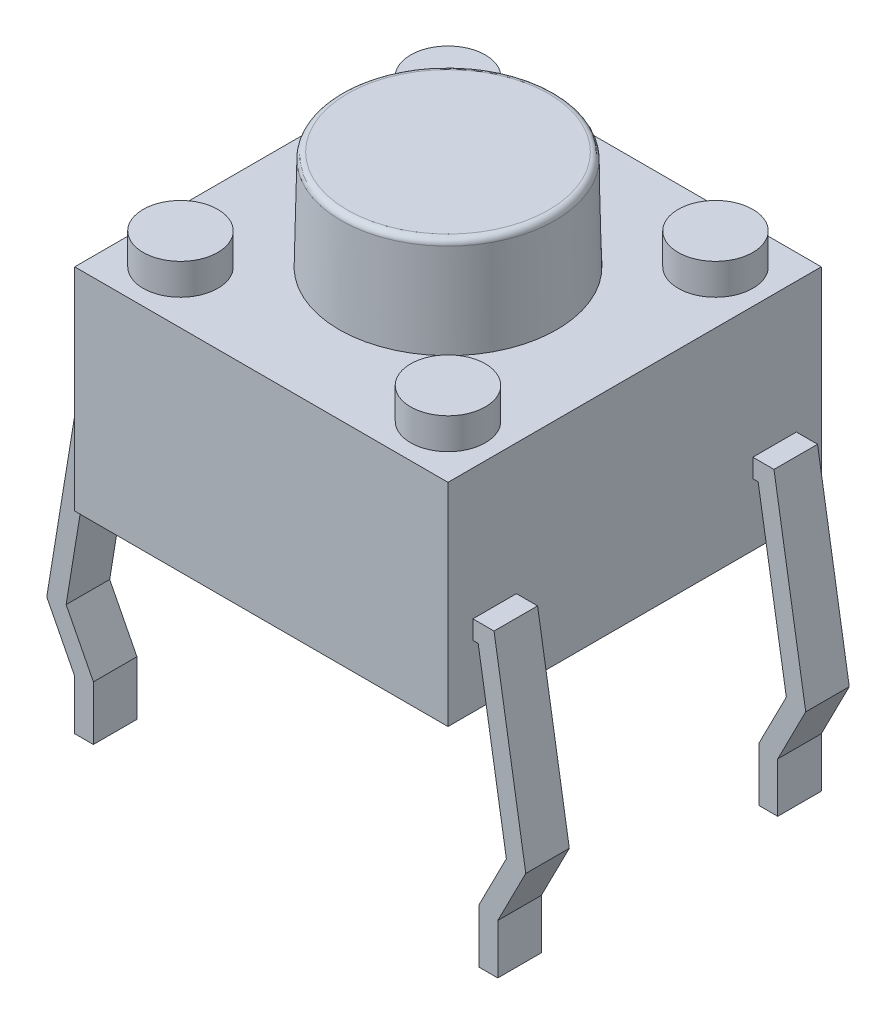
SolidWorks part; units mm, degrees
ref_plane "Piano frontale" through (0, 0, 0) normal (0, 0, 1) x (1, 0, 0)
ref_plane "Piano superiore" through (0, 0, 0) normal (0, 1, 0) x (1, 0, 0)
ref_plane "Piano destro" through (0, 0, 0) normal (1, 0, 0) x (0, 0, -1)
ref_plane "Piano1" through (0, 2, 0) normal (0, -1, 0) x (1, 0, 0)
sketch "Schizzo1" plane through (0, 2, 0) normal (0, -1, 0) x (1, 0, 0)
  line L0 (-7.16, -14) -> (-13.84, -14)
  line L1 (-13.84, -14) -> (-13.84, -17.8)
  line L2 (-13.84, -17.8) -> (-7.16, -17.8)
  line L3 (-7.16, -17.8) -> (-7.16, -14)
extrude "Estrusione-Estrusione1" add sketch "Schizzo1" against normal blind 2.4
sketch "Schizzo2" plane through (0, 0, -14) normal (0, 0, 1) x (1, 0, 0)
  line L0 (-7.4149, 2) -> (-13.5851, 2)
  line L1 (-13.5851, 2) -> (-14.038, -0.7711)
  line L2 (-14.038, -0.7711) -> (-13.6, -1.6277)
  line L3 (-13.6, -1.6277) -> (-13.6, -2.5)
  line L4 (-13.6, -2.5) -> (-14.6246, -2.5)
  line L5 (-14.6246, -2.5) -> (-13.84, 2.3)
  line L6 (-13.84, 2.3) -> (-13.84, 4.4)
  line L7 (-13.84, 4.4) -> (-7.16, 4.4)
  line L8 (-7.16, 4.4) -> (-7.16, 2.3)
  line L9 (-7.16, 2.3) -> (-6.3754, -2.5)
  line L10 (-6.3754, -2.5) -> (-7.4, -2.5)
  line L11 (-7.4, -2.5) -> (-7.4, -1.6277)
  line L12 (-7.4, -1.6277) -> (-6.962, -0.7711)
  line L13 (-6.962, -0.7711) -> (-7.4149, 2)
extrude "Estrusione-Estrusione2" add sketch "Schizzo2" along normal blind 0.7
sketch "Schizzo3" plane through (0, 0, -17.8) normal (0, 0, -1) x (-1, 0, 0)
  line L0 (13.84, 2.3) -> (14.6246, -2.5)
  line L1 (14.6246, -2.5) -> (13.6, -2.5)
  line L2 (13.6, -2.5) -> (13.6, -1.6277)
  line L3 (13.6, -1.6277) -> (14.038, -0.7711)
  line L4 (14.038, -0.7711) -> (13.5851, 2)
  line L5 (13.5851, 2) -> (7.4149, 2)
  line L6 (7.4149, 2) -> (6.962, -0.7711)
  line L7 (6.962, -0.7711) -> (7.4, -1.6277)
  line L8 (7.4, -1.6277) -> (7.4, -2.5)
  line L9 (7.4, -2.5) -> (6.3754, -2.5)
  line L10 (6.3754, -2.5) -> (7.16, 2.3)
  line L11 (7.16, 2.3) -> (7.16, 4.4)
  line L12 (7.16, 4.4) -> (13.84, 4.4)
  line L13 (13.84, 4.4) -> (13.84, 2.3)
extrude "Estrusione-Estrusione3" add sketch "Schizzo3" along normal blind 0.7
sketch "Schizzo4" plane through (0, 0, -13.3) normal (0, 0, 1) x (1, 0, 0)
  line L0 (-7.16, 2) -> (-13.84, 2)
  line L1 (-13.84, 2) -> (-13.84, 4.4)
  line L2 (-13.84, 4.4) -> (-7.16, 4.4)
  line L3 (-7.16, 4.4) -> (-7.16, 2)
extrude "Estrusione-Estrusione4" add sketch "Schizzo4" along normal blind 0.4
sketch "Schizzo5" plane through (-13.84, 0, 0) normal (-1, 0, 0) x (0, 0, 1)
  line L0 (-12.9, 4.4) -> (-18.5, 4.4)
  line L1 (-18.5, 4.4) -> (-18.5, 2.3)
  line L2 (-18.5, 2.3) -> (-17.8, 2.3)
  line L3 (-17.8, 2.3) -> (-17.8, 2)
  line L4 (-17.8, 2) -> (-14, 2)
  line L5 (-14, 2) -> (-14, 2.3)
  line L6 (-14, 2.3) -> (-13.3, 2.3)
  line L7 (-13.3, 2.3) -> (-13.3, 2)
  line L8 (-13.3, 2) -> (-12.9, 2)
  line L9 (-12.9, 2) -> (-12.9, 4.4)
extrude "Taglio-Estrusione1" cut sketch "Schizzo5" against normal blind 0.34
sketch "Schizzo6" plane through (-7.16, 0, 0) normal (1, 0, 0) x (0, 0, -1)
  line L0 (17.8, 2.3) -> (18.5, 2.3)
  line L1 (18.5, 2.3) -> (18.5, 4.4)
  line L2 (18.5, 4.4) -> (12.9, 4.4)
  line L3 (12.9, 4.4) -> (12.9, 2)
  line L4 (12.9, 2) -> (13.3, 2)
  line L5 (13.3, 2) -> (13.3, 2.3)
  line L6 (13.3, 2.3) -> (14, 2.3)
  line L7 (14, 2.3) -> (14, 2)
  line L8 (14, 2) -> (17.8, 2)
  line L9 (17.8, 2) -> (17.8, 2.3)
extrude "Taglio-Estrusione2" cut sketch "Schizzo6" against normal blind 0.34
sketch "Schizzo7" plane through (0, 0, -18.5) normal (0, 0, -1) x (-1, 0, 0)
  line L0 (7.5, 2) -> (7.5, 4.4)
  line L1 (7.5, 4.4) -> (13.5, 4.4)
  line L2 (13.5, 4.4) -> (13.5, 2)
  line L3 (13.5, 2) -> (7.5, 2)
extrude "Estrusione-Estrusione5" add sketch "Schizzo7" along normal blind 0.4
sketch "Schizzo8" plane through (0, 2, 0) normal (0, -1, 0) x (1, 0, 0)
  line L0 (-7.5, -12.9) -> (-7.5, -18.9)
  line L1 (-7.5, -18.9) -> (-13.5, -18.9)
  line L2 (-13.5, -18.9) -> (-13.5, -12.9)
  line L3 (-13.5, -12.9) -> (-7.5, -12.9)
extrude "Estrusione-Estrusione6" add sketch "Schizzo8" along normal blind 1
sketch "Schizzo9" plane through (0, 0, -13.3) normal (0, 0, 1) x (1, 0, 0)
  line L0 (-13.9, -2.5) -> (-13.9, -1.7)
  line L1 (-13.9, -1.7) -> (-14.35, -0.82)
  line L2 (-14.35, -0.82) -> (-14.6246, -2.5)
  line L3 (-14.6246, -2.5) -> (-13.9, -2.5)
extrude "Taglio-Estrusione3" cut sketch "Schizzo9" against normal up to next
sketch "Schizzo10" plane through (0, 0, -18.5) normal (0, 0, -1) x (-1, 0, 0)
  line L0 (14.6246, -2.5) -> (14.35, -0.82)
  line L1 (14.35, -0.82) -> (13.9, -1.7)
  line L2 (13.9, -1.7) -> (13.9, -2.5)
  line L3 (13.9, -2.5) -> (14.6246, -2.5)
extrude "Taglio-Estrusione4" cut sketch "Schizzo10" against normal up to next
sketch "Schizzo11" plane through (0, 0, -13.3) normal (0, 0, 1) x (1, 0, 0)
  line L0 (-6.65, -0.82) -> (-7.1, -1.7)
  line L1 (-7.1, -1.7) -> (-7.1, -2.5)
  line L2 (-7.1, -2.5) -> (-6.3754, -2.5)
  line L3 (-6.3754, -2.5) -> (-6.65, -0.82)
extrude "Taglio-Estrusione5" cut sketch "Schizzo11" against normal up to next
sketch "Schizzo12" plane through (0, 0, -18.5) normal (0, 0, -1) x (-1, 0, 0)
  line L0 (6.3754, -2.5) -> (7.1, -2.5)
  line L1 (7.1, -2.5) -> (7.1, -1.7)
  line L2 (7.1, -1.7) -> (6.65, -0.82)
  line L3 (6.65, -0.82) -> (6.3754, -2.5)
extrude "Taglio-Estrusione6" cut sketch "Schizzo12" against normal through all
ref_plane "Piano2" through (0, 0, -18.05) normal (0, 0, 1) x (1, 0, 0)
sketch "Schizzo13" plane through (0, 0, -18.05) normal (0, 0, 1) x (1, 0, 0)
  line L0 (-7.75, 4.9) -> (-8.35, 4.9)
  line L1 (-8.35, 4.9) -> (-8.35, 4.4)
  line L2 (-8.35, 4.4) -> (-7.75, 4.4)
  line L3 (-7.75, 4.4) -> (-7.75, 4.9)
  line L4 (-8.35, 4.9) -> (-8.35, 4.4) construction
revolve "Rivoluzione1" add sketch "Schizzo13" angle 360 about L4
ref_plane "Piano3" through (0, 0, -13.75) normal (0, 0, 1) x (1, 0, 0)
sketch "Schizzo14" plane through (0, 0, -13.75) normal (0, 0, 1) x (1, 0, 0)
  line L0 (-12.05, 4.9) -> (-12.65, 4.9)
  line L1 (-12.65, 4.9) -> (-12.65, 4.4)
  line L2 (-12.65, 4.4) -> (-12.05, 4.4)
  line L3 (-12.05, 4.4) -> (-12.05, 4.9)
  line L4 (-12.65, 4.9) -> (-12.65, 4.4) construction
revolve "Rivoluzione2" add sketch "Schizzo14" angle 360 about L4
sketch "Schizzo15" plane through (0, 0, -18.05) normal (0, 0, 1) x (1, 0, 0)
  line L0 (-12.05, 4.9) -> (-12.65, 4.9)
  line L1 (-12.65, 4.9) -> (-12.65, 4.4)
  line L2 (-12.65, 4.4) -> (-12.05, 4.4)
  line L3 (-12.05, 4.4) -> (-12.05, 4.9)
  line L4 (-12.65, 4.9) -> (-12.65, 4.4) construction
revolve "Rivoluzione3" add sketch "Schizzo15" angle 360 about L4
sketch "Schizzo16" plane through (0, 0, -13.75) normal (0, 0, 1) x (1, 0, 0)
  line L0 (-7.75, 4.9) -> (-8.35, 4.9)
  line L1 (-8.35, 4.9) -> (-8.35, 4.4)
  line L2 (-8.35, 4.4) -> (-7.75, 4.4)
  line L3 (-7.75, 4.4) -> (-7.75, 4.9)
  line L4 (-8.35, 4.9) -> (-8.35, 4.4) construction
revolve "Rivoluzione4" add sketch "Schizzo16" angle 360 about L4
hole_wizard "Foro Ø3.5 (3.5)-1" positions "Schizzo18" profile "Schizzo17" hole size "Ø3.5" standard "Ansi Metric"
sketch "Schizzo18" plane through (0, 4.4, 0) normal (0, 1, 0) x (1, 0, 0)
  point P0 (-10.5, 15.9)
sketch "Schizzo17" plane through (-10.5, 4.4, -15.9) normal (1, 0, 0) x (0, 0, 1)
  line L0 (0, 0) -> (0, 1)
  line L1 (0, 1) -> (1.75, 1)
  line L2 (1.75, 1) -> (1.75, 0)
  line L5 (1.75, 0) -> (0, 0)
  line L10 (0, 1) -> (-1.75, 1) construction
  line L11 (0, -6.35) -> (0, 107.95) construction
  dimension "Hole Dia." = 3.5
  dimension "Hole Depth" = 1
  dimension "Drill Angle" = 180
imported_body "Importato3"
